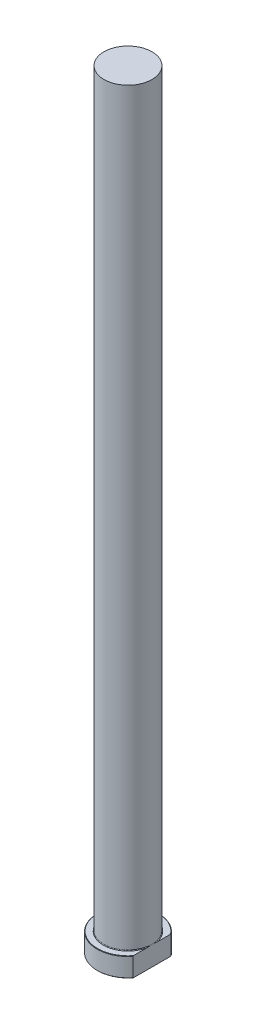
SolidWorks part; units mm, degrees
ref_plane "Front Plane" through (0, 0, 0) normal (0, 0, 1) x (1, 0, 0)
ref_plane "Top Plane" through (0, 0, 0) normal (0, 1, 0) x (1, 0, 0)
ref_plane "Right Plane" through (0, 0, 0) normal (1, 0, 0) x (0, 0, -1)
sketch "Sketch1" plane through (0, 0, 0) normal (0, 0, 1) x (1, 0, 0)
  line L0 (0, 259.9588) -> (0, -15.1925) construction
  line L1 (0, 0) -> (-16, 0)
  line L2 (-16, 0) -> (-16, 10)
  line L3 (-16, 10) -> (-12.5, 10)
  line L4 (-12.5, 10) -> (-12.5, 400)
  line L5 (-12.5, 400) -> (0, 400)
  line L6 (0, 400) -> (0, 0)
  dimension "L" = 400
  dimension "H" = 32
  dimension "T" = 10
  dimension "D" = 25
revolve "Revolve1" add sketch "Sketch1" angle 360 about L0
chamfer "Chamfer1" distance 0.2 angle 45 2 edges at (0, 10, 16) (0, 0, 16)
fillet "Fillet1" radius 0.3 1 edges at (0, 10, 12.5)
sketch "Sketch2" plane through (0, 0, 0) normal (0, 1, 0) x (1, 0, 0)
  line L0 (12.5, 9.9875) -> (12.5, -9.9875)
  circle A0 centre (0, 0) radius 16 construction
  arc A1 (12.5, -9.9875) -> (12.5, 9.9875) centre (0, 0) ccw
  circle A2 centre (0, 0) radius 12.5 construction
extrude "KEY" cut sketch "Sketch2" along normal through all
